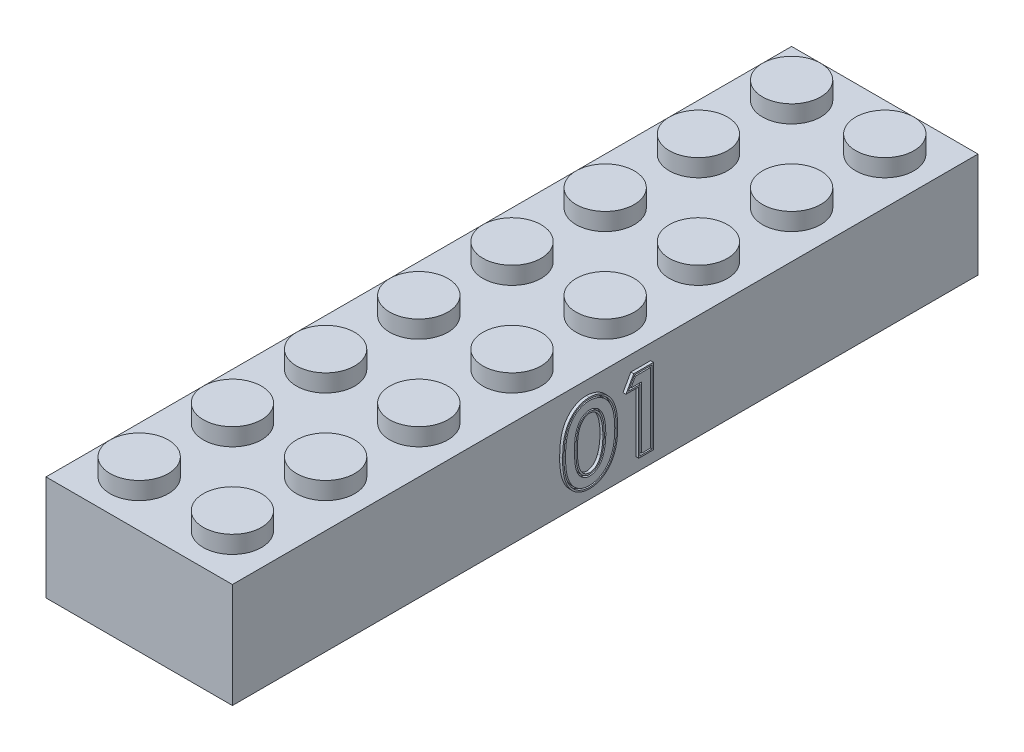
SolidWorks part; units mm, degrees
ref_plane "Face" through (0, 0, 0) normal (0, 0, 1) x (1, 0, 0)
ref_plane "Dessus" through (0, 0, 0) normal (0, 1, 0) x (1, 0, 0)
ref_plane "Droite" through (0, 0, 0) normal (1, 0, 0) x (0, 0, -1)
sketch "Esquisse2" plane through (0, 0, 0) normal (0, 1, 0) x (1, 0, 0)
  line L1 (0, 0) -> (16, 0)
  line L2 (0, 0) -> (0, -64)
  line L3 (0, -64) -> (16, -64)
  line L4 (16, 0) -> (16, -64)
  dimension "D1" = 16
  dimension "D2" = 64
extrude "Extrusion1" add sketch "Esquisse2" against normal blind 1
sketch "Esquisse3" plane through (0, -1, 0) normal (0, -1, 0) x (1, 0, 0)
  line L1 (16, 64) -> (0, 64)
  line L2 (16, 64) -> (16, 0)
  line L3 (16, 0) -> (0, 0)
  line L4 (0, 64) -> (0, 0)
  line L5 (1, 1) -> (15, 1)
  line L6 (1, 1) -> (1, 63)
  line L7 (1, 63) -> (15, 63)
  line L8 (15, 1) -> (15, 63)
  dimension "D1" = 1
  dimension "D2" = 1
  dimension "D3" = 1
  dimension "D4" = 1
extrude "Extrusion2" add sketch "Esquisse3" along normal blind 8
sketch "Esquisse4" plane through (0, -1, 0) normal (0, -1, 0) x (1, 0, 0)
  line L0 (16, 64) -> (0, 64) construction
  line L1 (16, 0) -> (16, 64) construction
  line L2 (0, 0) -> (16, 0) construction
  circle A0 centre (8, 56) radius 2.875
  circle A1 centre (7.9045, 48) radius 2.875
  circle A2 centre (7.9045, 40) radius 2.875
  circle A3 centre (7.9045, 32) radius 2.875
  circle A4 centre (7.9045, 24) radius 2.875
  circle A5 centre (7.9045, 16) radius 2.875
  circle A6 centre (7.9045, 8) radius 2.875
  circle A7 centre (8, 56) radius 2.5
  circle A8 centre (7.9045, 48) radius 2.5
  circle A9 centre (7.9045, 40) radius 2.5
  circle A10 centre (7.9045, 32) radius 2.5
  circle A11 centre (7.9045, 24) radius 2.5
  circle A12 centre (7.9045, 16) radius 2.5
  circle A13 centre (7.9045, 8) radius 2.5
  dimension "D4" = 5.75
  dimension "D5" = 5.75
  dimension "D6" = 5.75
  dimension "D7" = 5.75
  dimension "D8" = 5.75
  dimension "D9" = 5.75
  dimension "D10" = 5.75
  dimension "D17" = 5
  dimension "D18" = 5
  dimension "D19" = 5
  dimension "D20" = 5
  dimension "D21" = 5
  dimension "D22" = 5
  dimension "D23" = 5
  dimension "D1" = 8
  dimension "D2" = 8
  dimension "D3" = 8
  dimension "D11" = 8
  dimension "D12" = 8
  dimension "D13" = 8
  dimension "D14" = 8
  dimension "D15" = 8
  dimension "D16" = 8
extrude "Extrusion3" add sketch "Esquisse4" along normal blind 8
sketch "Esquisse5" plane through (0, -1, 0) normal (0, -1, 0) x (1, 0, 0)
  line L0 (16, 64) -> (0, 64) construction
  line L1 (16, 0) -> (16, 64) construction
  line L2 (14.9745, 56.25) -> (14.9745, 55.75)
  line L3 (10.8641, 56.25) -> (14.9745, 56.25)
  line L4 (1.0479, 56.25) -> (1.0479, 55.75)
  line L5 (10.8641, 55.75) -> (14.9745, 55.75)
  line L7 (5.1359, 56.25) -> (1.0479, 56.25)
  line L9 (5.1359, 55.75) -> (1.0479, 55.75)
  arc A0 (5.1359, 56.25) -> (5.1359, 55.75) centre (8, 56) ccw
  circle A1 centre (8, 56) radius 2.875 construction
  arc A2 (10.8641, 55.75) -> (10.8641, 56.25) centre (8, 56) ccw
  dimension "D1" = 8
  dimension "D2" = 8
  dimension "D3" = 0.25
  dimension "D4" = 0.25
  dimension "D5" = 0.25
  dimension "D6" = 0.25
extrude "Extrusion4" add sketch "Esquisse5" along normal blind 6
pattern_linear "Répétition linéaire1" count 7 spacing 8 along (0, 0, -1) of "Extrusion4"
sketch "Esquisse6" plane through (0, 0, 0) normal (0, 1, 0) x (-1, 0, 0)
  line L0 (0, 0) -> (0, 64) construction
  line L1 (-16, 0) -> (0, 0) construction
  circle A0 centre (-12, 4) radius 2.5
  circle A1 centre (-4, 4) radius 2.5
  dimension "D1" = 5
  dimension "D4" = 5
  dimension "D2" = 8
  dimension "D3" = 4
  dimension "D5" = 4
  dimension "D6" = 4
extrude "Extrusion5" add sketch "Esquisse6" along normal blind 1.5
pattern_linear "Répétition linéaire2" count 8 spacing 8 along (0, 0, 1) of "Extrusion5"
sketch "Sketch1" plane through (16, 0, 0) normal (1, 0, 0) x (0, 0, -1)
  line L0 (-29.657, -1.5578) -> (-28.3518, -1.5578)
  line L1 (-28.3518, -1.5578) -> (-28.3518, -7.5578)
  line L2 (-28.3518, -7.5578) -> (-29.121, -7.5578)
  line L3 (-29.121, -7.5578) -> (-29.121, -2.2501)
  line L4 (-29.121, -2.2501) -> (-30.0441, -2.2501)
  line L5 (-30.0441, -2.2501) -> (-29.657, -1.5578)
  line L6 (-30.2572, -2.3751) -> (-29.7304, -1.4328)
  line L7 (-29.7304, -1.4328) -> (-28.2268, -1.4328)
  line L8 (-28.2268, -1.4328) -> (-28.2268, -7.6828)
  line L9 (-28.2268, -7.6828) -> (-29.246, -7.6828)
  line L10 (-29.246, -7.6828) -> (-29.246, -2.3751)
  line L11 (-29.246, -2.3751) -> (-30.2572, -2.3751)
  line L12 (-29.371, -7.8078) -> (-29.371, -2.5001)
  line L13 (-29.371, -2.5001) -> (-30.4702, -2.5001)
  line L14 (-30.4702, -2.5001) -> (-29.8037, -1.3078)
  line L15 (-29.8037, -1.3078) -> (-28.1018, -1.3078)
  line L16 (-28.1018, -1.3078) -> (-28.1018, -7.8078)
  line L17 (-28.1018, -7.8078) -> (-29.371, -7.8078)
  spline S0 degree 3 poles (-35.6595, -4.5602) (-35.6596, -4.375) (-35.6537, -4.1052) (-35.6251, -3.7573) (-35.5986, -3.5209) (-35.5618, -3.3009) (-35.5198, -3.0971) (-35.468, -2.9096) (-35.4076, -2.738) (-35.3397, -2.5792) (-35.2651, -2.4312) (-35.1842, -2.2922) (-35.0976, -2.1623) (-35.0012, -2.0442) (-34.9005, -1.9341) (-34.792, -1.834) (-34.6765, -1.7443) (-34.557, -1.6633) (-34.4321, -1.5951) (-34.3047, -1.5356) (-34.1732, -1.4874) (-34.0385, -1.4501) (-33.8529, -1.4148) (-33.7108, -1.4025) (-33.615, -1.4039) knots 0 0 0 0 0.131292 0.191134 0.247469 0.299861 0.349217 0.394905 0.437665 0.478131 0.517254 0.555057 0.592083 0.627836 0.663012 0.697786 0.732388 0.766577 0.800014 0.833182 0.866161 0.899169 0.932146 1 1 1 1
  spline S1 degree 3 poles (-33.615, -1.4039) (-33.5115, -1.406) (-33.3566, -1.4124) (-33.1564, -1.4529) (-33.0108, -1.4905) (-32.8708, -1.542) (-32.7334, -1.6011) (-32.603, -1.676) (-32.475, -1.758) (-32.3539, -1.8525) (-32.2381, -1.9552) (-32.1312, -2.0696) (-32.0292, -2.1917) (-31.9375, -2.3264) (-31.8502, -2.4689) (-31.7729, -2.6228) (-31.6995, -2.7853) (-31.6364, -2.9608) (-31.5794, -3.1482) (-31.5331, -3.3499) (-31.4948, -3.5654) (-31.4652, -3.7948) (-31.4352, -4.1276) (-31.4303, -4.3846) (-31.4287, -4.5602) knots 0 0 0 0 0.071967 0.107094 0.141635 0.176209 0.210576 0.245316 0.280493 0.315985 0.351832 0.387834 0.424585 0.462157 0.50084 0.540519 0.581607 0.624545 0.669859 0.717555 0.768128 0.821703 0.878107 1 1 1 1
  spline S2 degree 3 poles (-31.4287, -4.5602) (-31.4305, -4.7348) (-31.4349, -4.9908) (-31.4656, -5.3218) (-31.4932, -5.5502) (-31.5319, -5.7648) (-31.579, -5.9656) (-31.6318, -6.1537) (-31.6964, -6.3275) (-31.7679, -6.4898) (-31.8455, -6.6423) (-31.931, -6.7852) (-32.0256, -6.9171) (-32.1248, -7.042) (-32.2331, -7.1557) (-32.3483, -7.2603) (-32.4703, -7.3544) (-32.5975, -7.4393) (-32.7309, -7.5109) (-32.8671, -7.5745) (-33.009, -7.6227) (-33.1539, -7.6638) (-33.3559, -7.6998) (-33.5108, -7.7115) (-33.615, -7.7116) knots 0 0 0 0 0.121433 0.177604 0.230909 0.281248 0.328982 0.374174 0.416884 0.457637 0.497347 0.535679 0.573213 0.610032 0.646457 0.682125 0.718035 0.753392 0.788268 0.823145 0.857652 0.892293 0.92767 1 1 1 1
  spline S3 degree 3 poles (-33.615, -7.7116) (-33.711, -7.7119) (-33.8538, -7.7025) (-34.0397, -7.6665) (-34.1739, -7.6293) (-34.3049, -7.582) (-34.4322, -7.5247) (-34.555, -7.4553) (-34.6744, -7.3774) (-34.7888, -7.2887) (-34.8952, -7.1885) (-34.9964, -7.0792) (-35.0904, -6.9595) (-35.1791, -6.8302) (-35.259, -6.6902) (-35.3336, -6.5409) (-35.4027, -6.3812) (-35.4651, -6.2082) (-35.5149, -6.0187) (-35.5619, -5.8146) (-35.5963, -5.594) (-35.6262, -5.3584) (-35.6503, -5.0121) (-35.6617, -4.7443) (-35.6595, -4.5602) knots 0 0 0 0 0.068176 0.101188 0.13423 0.166878 0.199963 0.233186 0.266859 0.301098 0.3357 0.37051 0.406745 0.443574 0.481662 0.52108 0.561961 0.605129 0.651412 0.700941 0.753668 0.809812 0.869411 1 1 1 1
  spline S4 degree 3 poles (-34.8902, -4.5578) (-34.891, -4.7137) (-34.8854, -4.9394) (-34.8678, -5.2299) (-34.8489, -5.4244) (-34.8237, -5.6036) (-34.7938, -5.7673) (-34.7598, -5.9157) (-34.7183, -6.0491) (-34.6723, -6.1707) (-34.6212, -6.2826) (-34.5682, -6.3874) (-34.5084, -6.483) (-34.4452, -6.5707) (-34.3772, -6.6502) (-34.307, -6.7233) (-34.2069, -6.8044) (-34.0786, -6.889) (-33.8707, -6.9858) (-33.7056, -7.0209) (-33.597, -7.0193) knots 0 0 0 0 0.151448 0.219301 0.282656 0.341217 0.395033 0.444216 0.489024 0.530658 0.570372 0.608492 0.644672 0.679781 0.713467 0.746217 0.778009 0.838458 0.89505 1 1 1 1
  spline S5 degree 3 poles (-33.597, -7.0193) (-33.476, -7.0182) (-33.2922, -6.9892) (-33.0656, -6.8861) (-32.9301, -6.7987) (-32.8277, -6.7136) (-32.7537, -6.6411) (-32.6856, -6.5602) (-32.6212, -6.4721) (-32.563, -6.3754) (-32.4866, -6.235) (-32.4431, -6.1203) (-32.4155, -6.0421) knots 0 0 0 0 0.221291 0.334387 0.453015 0.5149 0.57756 0.64198 0.708044 0.776747 0.84817 1 1 1 1
  spline S6 degree 3 poles (-32.4155, -6.0421) (-32.3788, -5.9359) (-32.3297, -5.771) (-32.2819, -5.5428) (-32.2503, -5.3613) (-32.2263, -5.1716) (-32.2037, -4.9032) (-32.1987, -4.6972) (-32.1979, -4.5578) knots 0 0 0 0 0.223635 0.341877 0.464062 0.590272 0.722322 1 1 1 1
  spline S7 degree 3 poles (-32.1979, -4.5578) (-32.1961, -4.4194) (-32.2043, -4.2169) (-32.2224, -3.9536) (-32.2449, -3.7713) (-32.2701, -3.5986) (-32.3047, -3.4365) (-32.3419, -3.2835) (-32.3883, -3.1414) (-32.439, -3.0089) (-32.4925, -2.8854) (-32.5503, -2.771) (-32.614, -2.6669) (-32.6812, -2.5715) (-32.7523, -2.4855) (-32.8282, -2.4092) (-32.9342, -2.3231) (-33.071, -2.2337) (-33.2957, -2.1274) (-33.4779, -2.0972) (-33.597, -2.0962) knots 0 0 0 0 0.131948 0.193278 0.251784 0.307087 0.359787 0.409848 0.457233 0.502239 0.545203 0.585547 0.624486 0.6615 0.696786 0.730841 0.763975 0.82695 0.886296 1 1 1 1
  spline S8 degree 3 poles (-33.597, -2.0962) (-33.7059, -2.0951) (-33.8713, -2.129) (-34.0786, -2.2266) (-34.206, -2.3113) (-34.3053, -2.3923) (-34.3765, -2.4637) (-34.4422, -2.5436) (-34.5057, -2.6306) (-34.5636, -2.7269) (-34.6198, -2.8306) (-34.6694, -2.9435) (-34.716, -3.0651) (-34.7571, -3.1988) (-34.7926, -3.347) (-34.8243, -3.5105) (-34.8472, -3.69) (-34.8664, -3.8848) (-34.8864, -4.1756) (-34.8905, -4.4019) (-34.8902, -4.5578) knots 0 0 0 0 0.105359 0.161617 0.22176 0.253563 0.286046 0.319493 0.35407 0.390593 0.428562 0.468644 0.510292 0.555115 0.604404 0.65831 0.716838 0.780213 0.848503 1 1 1 1
  spline S9 degree 1 poles (-35.7845, -4.5594) (-33.6128, -1.2789) knots 0 0 1 1 construction
  spline S10 degree 1 poles (-33.6128, -1.2789) (-31.3037, -4.5602) knots 0 0 1 1 construction
  spline S11 degree 1 poles (-31.3037, -4.5602) (-33.6147, -7.8366) knots 0 0 1 1 construction
  spline S12 degree 1 poles (-33.6147, -7.8366) (-35.7845, -4.5594) knots 0 0 1 1 construction
  spline S13 degree 3 poles (-35.7845, -4.5594) (-35.7847, -4.2012) (-35.7559, -3.4887) (-35.4846, -2.4079) (-34.7533, -1.5065) (-33.9851, -1.2734) (-33.6128, -1.2789) knots 0.00019 0.00019 0.00019 0.00019 0.250162 0.500134 0.750105 1.000077 1.000077 1.000077 1.000077
  spline S14 degree 3 poles (-33.6128, -1.2789) (-33.2354, -1.2865) (-32.4589, -1.4812) (-31.6684, -2.3715) (-31.3398, -3.463) (-31.3071, -4.1937) (-31.3037, -4.5602) knots -0.000075 -0.000075 -0.000075 -0.000075 0.250016 0.500107 0.750198 1.000289 1.000289 1.000289 1.000289
  spline S15 degree 3 poles (-31.3037, -4.5602) (-31.3075, -4.9264) (-31.3391, -5.6565) (-31.667, -6.7478) (-32.4586, -7.6332) (-33.2367, -7.8361) (-33.6147, -7.8366) knots -0.000289 -0.000289 -0.000289 -0.000289 0.249777 0.499843 0.749909 0.999975 0.999975 0.999975 0.999975
  spline S16 degree 3 poles (-33.6147, -7.8366) (-33.9858, -7.8378) (-34.7529, -7.6183) (-35.4798, -6.7056) (-35.7523, -5.632) (-35.7888, -4.9178) (-35.7845, -4.5594) knots 0.000026 0.000026 0.000026 0.000026 0.249972 0.499918 0.749865 0.999811 0.999811 0.999811 0.999811
  spline S17 degree 1 poles (-35.9095, -4.5587) (-33.6106, -1.1539) knots 0 0 1 1 construction
  spline S18 degree 1 poles (-33.6106, -1.1539) (-31.1787, -4.5603) knots 0 0 1 1 construction
  spline S19 degree 1 poles (-31.1787, -4.5603) (-33.6144, -7.9616) knots 0 0 1 1 construction
  spline S20 degree 1 poles (-33.6144, -7.9616) (-35.9095, -4.5587) knots 0 0 1 1 construction
  spline S21 degree 3 poles (-35.9095, -4.5587) (-35.9097, -4.1945) (-35.881, -3.4758) (-35.6011, -2.3525) (-34.8289, -1.3975) (-34.0077, -1.1481) (-33.6106, -1.1539) knots 0.000376 0.000376 0.000376 0.000376 0.25032 0.500265 0.750209 1.000154 1.000154 1.000154 1.000154
  spline S22 degree 3 poles (-33.6106, -1.1539) (-33.2111, -1.1619) (-32.3897, -1.3691) (-31.5529, -2.3124) (-31.2149, -3.4481) (-31.1822, -4.187) (-31.1787, -4.5603) knots -0.000151 -0.000151 -0.000151 -0.000151 0.250031 0.500213 0.750395 1.000578 1.000578 1.000578 1.000578
  spline S23 degree 3 poles (-31.1787, -4.5603) (-31.1826, -4.9333) (-31.2142, -5.6715) (-31.5514, -6.8066) (-32.3889, -7.7452) (-33.2138, -7.961) (-33.6144, -7.9616) knots -0.000578 -0.000578 -0.000578 -0.000578 0.249555 0.499687 0.74982 0.999953 0.999953 0.999953 0.999953
  spline S24 degree 3 poles (-33.6144, -7.9616) (-34.0094, -7.9628) (-34.8264, -7.7288) (-35.5975, -6.7592) (-35.877, -5.6458) (-35.9138, -4.9234) (-35.9095, -4.5587) knots 0.000048 0.000048 0.000048 0.000048 0.249944 0.499839 0.749734 0.999629 0.999629 0.999629 0.999629
  spline S25 degree 1 poles (-33.5993, -2.3462) (-34.6402, -4.5582) knots 0 0 1 1 construction
  spline S26 degree 1 poles (-34.6402, -4.5582) (-33.5999, -6.7693) knots 0 0 1 1 construction
  spline S27 degree 1 poles (-33.5999, -6.7693) (-32.6515, -5.9597) knots 0 0 1 1 construction
  spline S28 degree 1 poles (-32.6515, -5.9597) (-32.4479, -4.5554) knots 0 0 1 1 construction
  spline S29 degree 1 poles (-32.4479, -4.5554) (-33.5993, -2.3462) knots 0 0 1 1 construction
  spline S30 degree 3 poles (-33.5993, -2.3462) (-33.7916, -2.3443) (-34.1679, -2.5216) (-34.5043, -3.0963) (-34.6233, -3.8033) (-34.6406, -4.3092) (-34.6402, -4.5582) knots -0.000069 -0.000069 -0.000069 -0.000069 0.250014 0.500098 0.750182 1.000266 1.000266 1.000266 1.000266
  spline S31 degree 3 poles (-34.6402, -4.5582) (-34.6415, -4.8071) (-34.6253, -5.3127) (-34.5037, -6.0199) (-34.232, -6.5015) (-33.8708, -6.7245) (-33.6927, -6.7707) (-33.5999, -6.7693) knots -0.000266 -0.000266 -0.000266 -0.000266 0.249854 0.499973 0.750093 0.875153 1.000212 1.000212 1.000212 1.000212
  spline S32 degree 3 poles (-33.5999, -6.7693) (-33.3895, -6.7674) (-33.0676, -6.6389) (-32.7923, -6.3012) (-32.6915, -6.0726) (-32.6515, -5.9597) knots -0.000403 -0.000403 -0.000403 -0.000403 0.499477 0.749417 0.999357 0.999357 0.999357 0.999357
  spline S33 degree 3 poles (-32.6515, -5.9597) (-32.4974, -5.5125) (-32.4504, -5.0284) (-32.4479, -4.5554) knots 0.000705 0.000705 0.000705 0.000705 1.000653 1.000653 1.000653 1.000653
  spline S34 degree 3 poles (-32.4479, -4.5554) (-32.4415, -4.0674) (-32.5233, -3.2748) (-32.9893, -2.5105) (-33.3969, -2.3479) (-33.5993, -2.3462) knots -0.000313 -0.000313 -0.000313 -0.000313 0.499878 0.749973 1.000069 1.000069 1.000069 1.000069
  spline S35 degree 1 poles (-33.5981, -2.2212) (-34.7652, -4.558) knots 0 0 1 1 construction
  spline S36 degree 1 poles (-34.7652, -4.558) (-33.5984, -6.8943) knots 0 0 1 1 construction
  spline S37 degree 1 poles (-33.5984, -6.8943) (-32.5335, -6.0009) knots 0 0 1 1 construction
  spline S38 degree 1 poles (-32.5335, -6.0009) (-32.3229, -4.5566) knots 0 0 1 1 construction
  spline S39 degree 1 poles (-32.3229, -4.5566) (-33.5981, -2.2212) knots 0 0 1 1 construction
  spline S40 degree 3 poles (-33.5981, -2.2212) (-33.8203, -2.219) (-34.2629, -2.4257) (-34.6254, -3.0581) (-34.7483, -3.7946) (-34.7656, -4.3049) (-34.7652, -4.558) knots -0.000035 -0.000035 -0.000035 -0.000035 0.250007 0.500049 0.750091 1.000133 1.000133 1.000133 1.000133
  spline S41 degree 3 poles (-34.7652, -4.558) (-34.7665, -4.811) (-34.7495, -5.3211) (-34.6277, -6.0586) (-34.2627, -6.6906) (-33.8205, -6.8975) (-33.5984, -6.8943) knots -0.000133 -0.000133 -0.000133 -0.000133 0.249927 0.499987 0.750046 1.000106 1.000106 1.000106 1.000106
  spline S42 degree 3 poles (-33.5984, -6.8943) (-33.3593, -6.8921) (-32.8709, -6.7057) (-32.6166, -6.2358) (-32.5335, -6.0009) knots -0.000201 -0.000201 -0.000201 -0.000201 0.499743 0.999687 0.999687 0.999687 0.999687
  spline S43 degree 3 poles (-32.5335, -6.0009) (-32.3749, -5.5409) (-32.3255, -5.0431) (-32.3229, -4.5566) knots 0.000342 0.000342 0.000342 0.000342 1.000327 1.000327 1.000327 1.000327
  spline S44 degree 3 poles (-32.3229, -4.5566) (-32.3195, -4.3008) (-32.3477, -3.7856) (-32.5184, -3.0428) (-32.9017, -2.4089) (-33.3683, -2.2231) (-33.5981, -2.2212) knots -0.000156 -0.000156 -0.000156 -0.000156 0.249891 0.499939 0.749987 1.000034 1.000034 1.000034 1.000034
  dimension "D1" = 0.125
  dimension "D2" = 0.25
  dimension "D3" = 0.25
  dimension "D4" = 0.125
  dimension "D5" = 0.125
  dimension "D6" = 0.125
extrude "Boss-Extrude1" add sketch "Sketch1" along normal blind 0.25 contours S43 S44 S40 S41 S42 S34 S33 S32 S31 S30 | S3 S2 S1 S0 S8 S7 S6 S5 S4 | S24 S23 S22 S21 S15 S16 S13 S14 | L17 L16 L15 L14 L13 L12 L10 L11 L6 L7 L8 L9 | L5 L4 L3 L2 L1 L0
